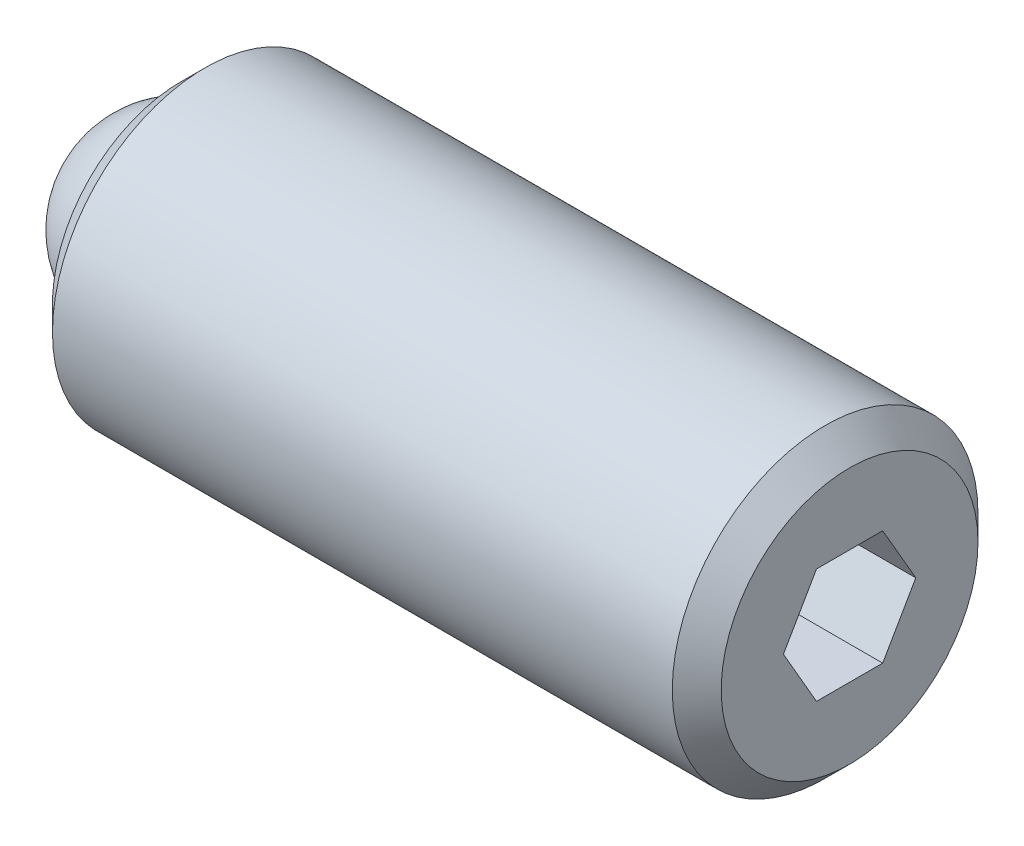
SolidWorks part; units mm, degrees
ref_plane "Front Plane" through (0, 0, 0) normal (0, 0, 1) x (1, 0, 0)
ref_plane "Top Plane" through (0, 0, 0) normal (0, 1, 0) x (1, 0, 0)
ref_plane "Right Plane" through (0, 0, 0) normal (1, 0, 0) x (0, 0, -1)
sketch "Sketch2" plane through (0, 0, 0) normal (1, 0, 0) x (0, 0, -1)
  circle A0 centre (0, 0) radius 3.175
  dimension "D1" = 6.35
extrude "Boss-Extrude1" add sketch "Sketch2" along normal blind 13.8906
sketch "Sketch3" plane through (0, 0, 0) normal (-1, 0, 0) x (0, 0, 1)
  circle A0 centre (0, 0) radius 1.9812
  dimension "D1" = 3.9624
chamfer "Chamfer1" distance 0.508 angle 45 1 edges at (0, 0, -3.175)
chamfer "Chamfer2" distance 0.508 angle 45 1 edges at (13.8906, 0, -3.175)
sketch "Sketch4" plane through (13.8906, 0, 0) normal (1, 0, 0) x (0, 0, -1)
  line L1 (1.3748, 0) -> (0.6874, 1.1906)
  line L2 (0.6874, 1.1906) -> (-0.6874, 1.1906)
  line L3 (-0.6874, 1.1906) -> (-1.3748, 0)
  line L4 (-1.3748, 0) -> (-0.6874, -1.1906)
  line L5 (-0.6874, -1.1906) -> (0.6874, -1.1906)
  line L6 (0.6874, -1.1906) -> (1.3748, 0)
  circle A0 centre (0, 0) radius 1.1906 construction
  dimension "D1" = 2.3813
extrude "Cut-Extrude2" cut sketch "Sketch4" against normal blind 2.286
extrude "Cut-Extrude3" cut sketch "Sketch3" against normal blind 1.9844
sketch "Sketch5" plane through (0, 0, 0) normal (-1, 0, 0) x (0, 0, 1)
  line L0 (0, 0) -> (0, -1.9844)
  line L1 (0, 0) -> (0, 1.9844)
  arc A0 (0, 1.9844) -> (0, -1.9844) centre (0, 0) ccw
  dimension "D1" = 1.9844
revolve "Revolve1" add sketch "Sketch5" angle 360 about L1
